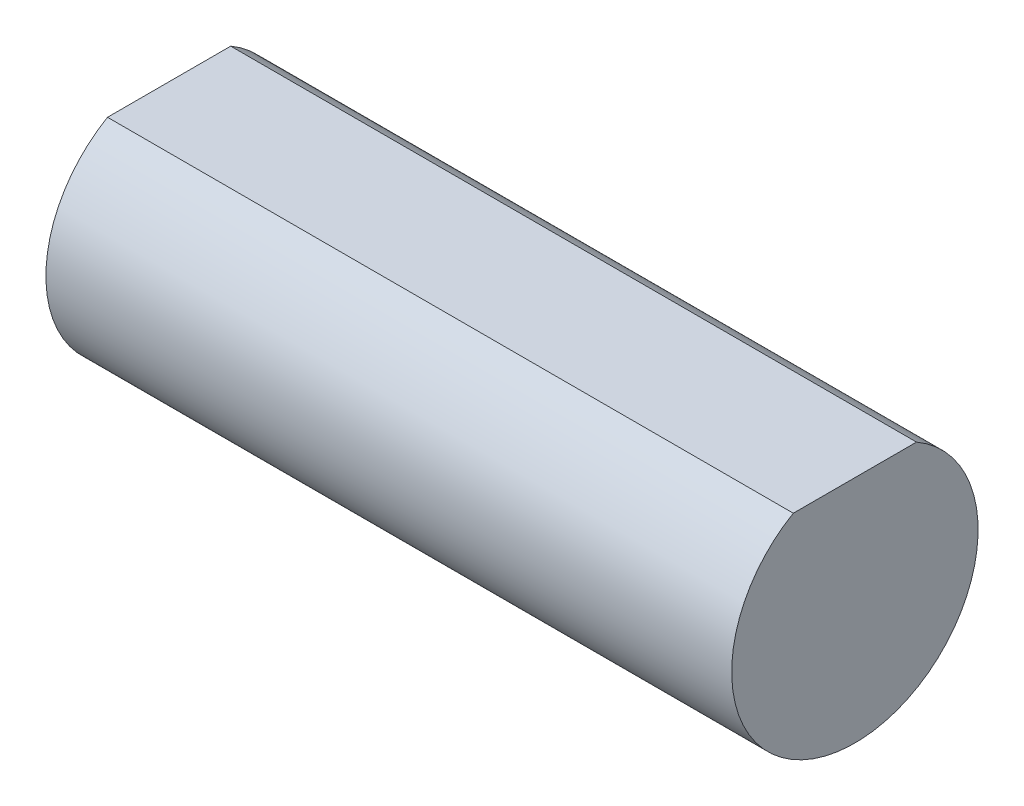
SolidWorks part; units mm, degrees
ref_plane "Front Plane" through (0, 0, 0) normal (0, 0, 1) x (1, 0, 0)
ref_plane "Top Plane" through (0, 0, 0) normal (0, 1, 0) x (1, 0, 0)
ref_plane "Right Plane" through (0, 0, 0) normal (1, 0, 0) x (0, 0, -1)
sketch "Sketch1" plane through (0, 0, 0) normal (1, 0, 0) x (0, 0, -1)
  line L1 (1.5, 2.5981) -> (-1.5, 2.5981)
  line L2 (-1.5, 2.5981) -> (-3, 0) construction
  line L3 (-3, 0) -> (-1.5, -2.5981) construction
  line L4 (-1.5, -2.5981) -> (1.5, -2.5981) construction
  line L5 (1.5, -2.5981) -> (3, 0) construction
  line L6 (3, 0) -> (1.5, 2.5981) construction
  circle A0 centre (0, 0) radius 2.5981 construction
  arc A1 (-1.5, 2.5981) -> (1.5, 2.5981) centre (0, 0) ccw
  dimension "D2" = 6
extrude "Boss-Extrude1" add sketch "Sketch1" along normal blind 16.7
